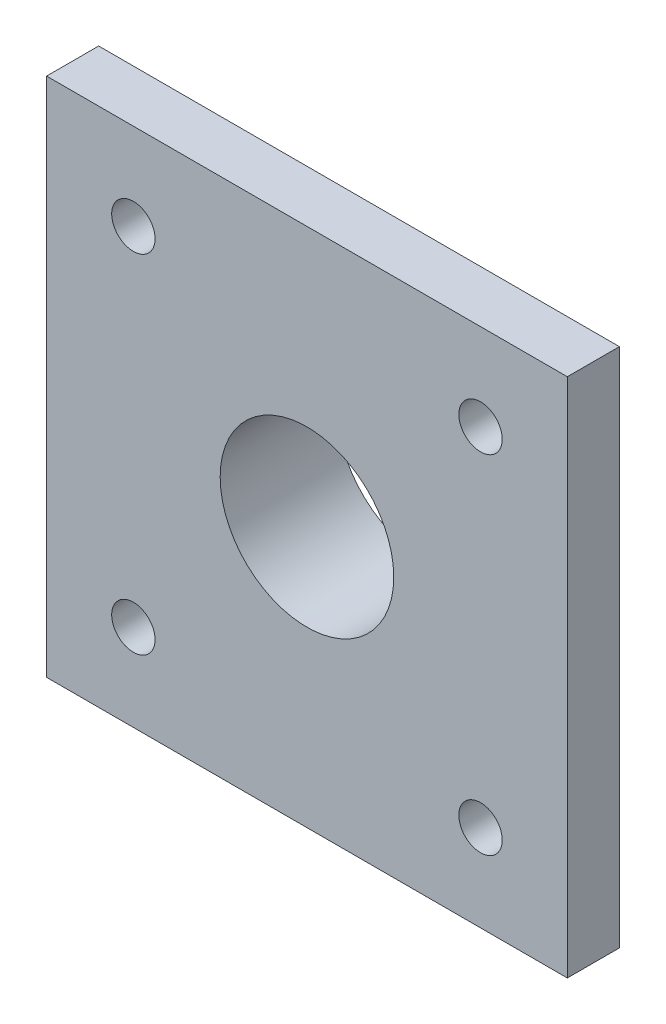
SolidWorks part; units mm, degrees
ref_plane "前视基准面" through (0, 0, 0) normal (0, 0, 1) x (1, 0, 0)
ref_plane "上视基准面" through (0, 0, 0) normal (0, 1, 0) x (1, 0, 0)
ref_plane "右视基准面" through (0, 0, 0) normal (1, 0, 0) x (0, 0, -1)
other "Configuration Table"
sketch "草图1" plane through (0, 0, 0) normal (0, 0, 1) x (1, 0, 0)
  line L1 (-60, -60) -> (60, -60)
  line L2 (-60, -60) -> (-60, 60)
  line L3 (-60, 60) -> (60, 60)
  line L4 (60, -60) -> (60, 60)
  line L5 (-60, -60) -> (60, 60) construction
  line L6 (-60, 60) -> (60, -60) construction
  point P0 (0, 0)
extrude "凸台-拉伸1" add sketch "草图1" against normal blind 12
sketch "草图2" plane through (0, 0, 0) normal (0, 0, 1) x (1, 0, 0)
  circle A0 centre (0, 0) radius 35
extrude "凸台-拉伸2" add sketch "草图2" against normal blind 27
sketch "草图3" plane through (0, 0, 0) normal (0, 0, 1) x (1, 0, 0)
  circle A0 centre (0, 0) radius 20
extrude "切除-拉伸1" cut sketch "草图3" against normal blind 27
sketch "草图4" plane through (0, 0, 0) normal (0, 0, 1) x (1, 0, 0)
  circle A0 centre (40, 40) radius 5
extrude "切除-拉伸2" cut sketch "草图4" against normal blind 12
sketch "草图5" plane through (0, 0, 0) normal (0, 0, 1) x (1, 0, 0)
  circle A0 centre (-40, 40) radius 5
extrude "切除-拉伸3" cut sketch "草图5" against normal blind 12
sketch "草图6" plane through (0, 0, 0) normal (0, 0, 1) x (1, 0, 0)
  circle A0 centre (-40, -40) radius 5
extrude "切除-拉伸4" cut sketch "草图6" against normal blind 12
sketch "草图7" plane through (0, 0, 0) normal (0, 0, 1) x (1, 0, 0)
  circle A0 centre (40, -40) radius 5
extrude "切除-拉伸5" cut sketch "草图7" against normal blind 12
